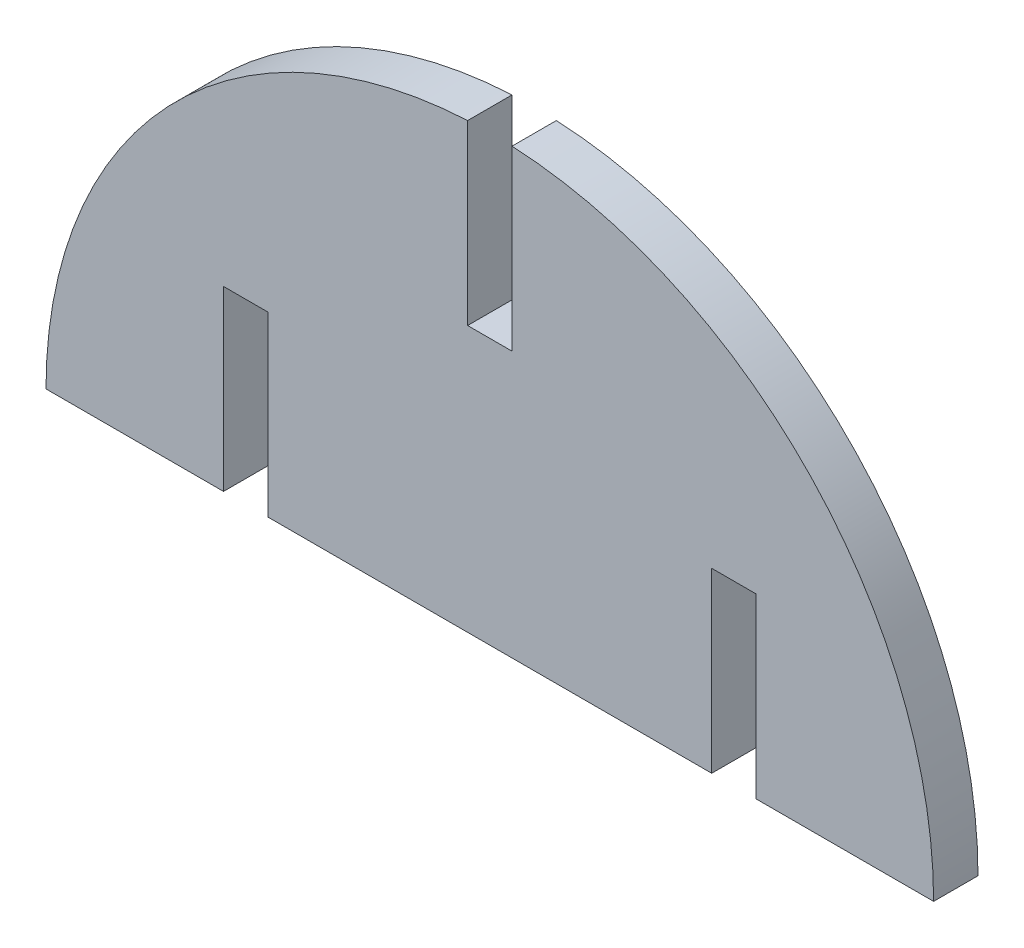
SolidWorks part; units mm, degrees
ref_plane "Front Plane" through (0, 0, 0) normal (0, 0, 1) x (1, 0, 0)
ref_plane "Top Plane" through (0, 0, 0) normal (0, 1, 0) x (1, 0, 0)
ref_plane "Right Plane" through (0, 0, 0) normal (1, 0, 0) x (0, 0, -1)
sketch "Sketch1" plane through (0, 0, 0) normal (0, 0, 1) x (1, 0, 0)
  line L0 (0, -221.4686) -> (0, 10851.9597) construction
  line L1 (-221.4686, 0) -> (10851.9597, 0) construction
  line L2 (-25, 0) -> (25, 0)
  arc A0 (25, 0) -> (-25, 0) centre (0, 0) ccw
  dimension "D1" = 50
  dimension "D2" = 50
extrude "Boss-Extrude1" add sketch "Sketch1" along normal blind 2.5
sketch "Sketch2" plane through (0, 0, 2.5) normal (0, 0, 1) x (1, 0, 0)
  line L0 (0, -1000) -> (0, 49000) construction
  line L1 (-25, 0) -> (25, 0) construction
  line L2 (-15, 0) -> (-15, 10)
  line L3 (-15, 10) -> (-12.5, 10)
  line L4 (-12.5, 10) -> (-12.5, 0)
  line L5 (-12.5, 0) -> (-15, 0)
  line L6 (12.5, 0) -> (15, 0)
  line L7 (15, 0) -> (15, 10)
  line L8 (15, 10) -> (12.5, 10)
  line L9 (12.5, 10) -> (12.5, 0)
  point P5 (0, 0)
extrude "Cut-Extrude7" cut sketch "Sketch2" against normal blind 2.5
sketch "Sketch3" plane through (0, 0, 2.5) normal (0, 0, 1) x (1, 0, 0)
sketch "Sketch4" plane through (0, 0, 2.5) normal (0, 0, 1) x (1, 0, 0)
  line L0 (0, -975) -> (0, 49025) construction
  line L1 (-1.25, 14.9687) -> (1.25, 14.9687)
  line L2 (1.25, 14.9687) -> (1.25, 24.9687)
  line L3 (-1.25, 14.9687) -> (-1.25, 24.9687)
  line L4 (-1.25, 24.9687) -> (0, 25)
  line L5 (0, 25) -> (1.25, 24.9687)
  line L15 (15, 10) -> (15, 0)
  line L16 (15, 0) -> (25, 0)
  line L17 (-25, 0) -> (-15, 0)
  line L18 (-15, 0) -> (-15, 10)
  line L19 (-15, 10) -> (-12.5, 10)
  line L20 (-12.5, 10) -> (-12.5, 0)
  line L21 (-12.5, 0) -> (12.5, 0)
  line L22 (12.5, 0) -> (12.5, 10)
  line L23 (12.5, 10) -> (15, 10)
  line L24 (15, 10) -> (15, 0)
  line L25 (15, 0) -> (25, 0)
  line L26 (-25, 0) -> (-15, 0)
  line L27 (-15, 0) -> (-15, 10)
  line L28 (-15, 10) -> (-12.5, 10)
  line L29 (-12.5, 10) -> (-12.5, 0)
  line L30 (-12.5, 0) -> (12.5, 0)
  line L31 (12.5, 0) -> (12.5, 10)
  line L32 (12.5, 10) -> (15, 10)
  arc A0 (25, 0) -> (-25, 0) centre (0, 0) ccw construction
  arc A2 (25, 0) -> (-25, 0) centre (0, 0) ccw
  arc A3 (25, 0) -> (-25, 0) centre (0, 0) ccw
  point P6 (0, 25)
  point P10 (0, 14.9687)
extrude "Cut-Extrude8" cut sketch "Sketch4" against normal blind 2.5 contours L2 L5 L4 L3 L1
equation "\"D1@Sketch4\"=\"D3@Sketch2\""
equation "\"D2@Sketch4\"=\"D2@Sketch2\"/2"
